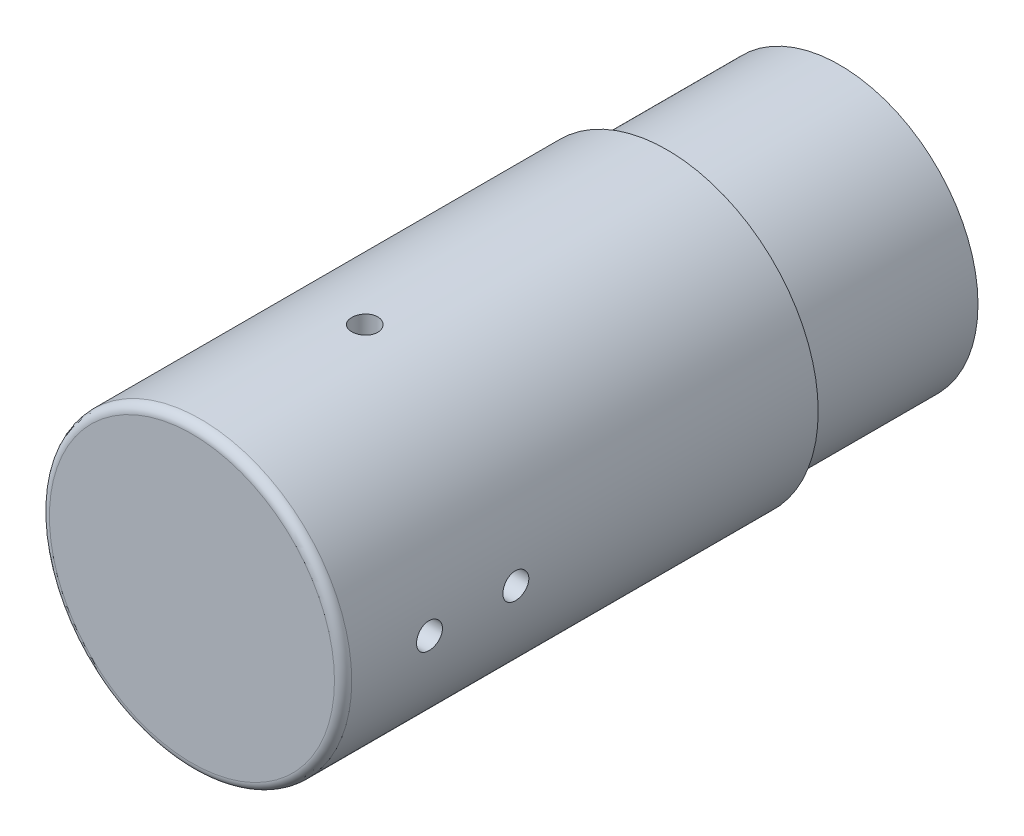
SolidWorks part; units mm, degrees
ref_plane "Ebene vorne" through (0, 0, 0) normal (0, 0, 1) x (1, 0, 0)
ref_plane "Ebene oben" through (0, 0, 0) normal (0, 1, 0) x (1, 0, 0)
ref_plane "Ebene rechts" through (0, 0, 0) normal (1, 0, 0) x (0, 0, -1)
sketch "Skizze1" plane through (0, 0, 0) normal (0, 0, 1) x (1, 0, 0)
  circle A0 centre (0, 0) radius 17.5
  dimension "D1" = 35
extrude "Aufsatz-Linear austragen1" add sketch "Skizze1" against normal blind 55
sketch "Skizze2" plane through (0, 0, -55) normal (0, 0, -1) x (-1, 0, 0)
  circle A0 centre (0, 0) radius 16
  dimension "D1" = 32
extrude "Aufsatz-Linear austragen2" add sketch "Skizze2" along normal blind 20
sketch "Skizze4" plane through (0, 0, 0) normal (1, 0, 0) x (0, 0, -1)
  line L0 (0, 0) -> (81.7852, 0) construction
  line L1 (0, 17.5) -> (0, -17.5) construction
  line L2 (5, 0) -> (5, -7)
  line L3 (5, -7) -> (43, -8.5)
  line L4 (43, -8.5) -> (45.5, -9.5)
  line L6 (45.5, -9.5) -> (75, -9.5)
  line L7 (75, -16) -> (75, 16) construction
  line L8 (75, -9.5) -> (75, 0)
  line L9 (5, 0) -> (75, 0)
  dimension "D1" = 5
  dimension "D2" = 14
  dimension "D3" = 17
  dimension "D4" = 19
  dimension "D5" = 38
  dimension "D6" = 2.5
revolve "Schnitt-Rotation1" cut sketch "Skizze4" angle 360 about L0
ref_plane "Ebene1" through (17.5, 0, 0) normal (1, 0, 0) x (0, 0, -1)
sketch "Skizze5" plane through (17.5, 0, 0) normal (1, 0, 0) x (0, 0, -1)
  line L0 (0, 0) -> (77.9486, 0) construction
  line L1 (0, 17.5) -> (0, -17.5) construction
  circle A0 centre (20, 0) radius 1.5
  dimension "D1" = 3
  dimension "D2" = 20
extrude "Schnitt-Linear austragen1" cut sketch "Skizze5" against normal blind 20
pattern_circular "Kreismuster2" count 4 over 360 about axis through (0, 0, 0) along (0, 0, 1) of "Schnitt-Linear austragen1"
fillet "Verrundung1" radius 1 1 edges at (17.5, 0, 0)
sketch "Skizze6" plane through (17.5, 0, 0) normal (1, 0, 0) x (0, 0, -1)
  line L0 (0, 0) -> (82.585, 0) construction
  line L1 (0, 16.5) -> (0, -16.5) construction
  circle A0 centre (10, 0) radius 1.5
  dimension "D1" = 3
  dimension "D2" = 10
extrude "Schnitt-Linear austragen2" cut sketch "Skizze6" against normal blind 15
